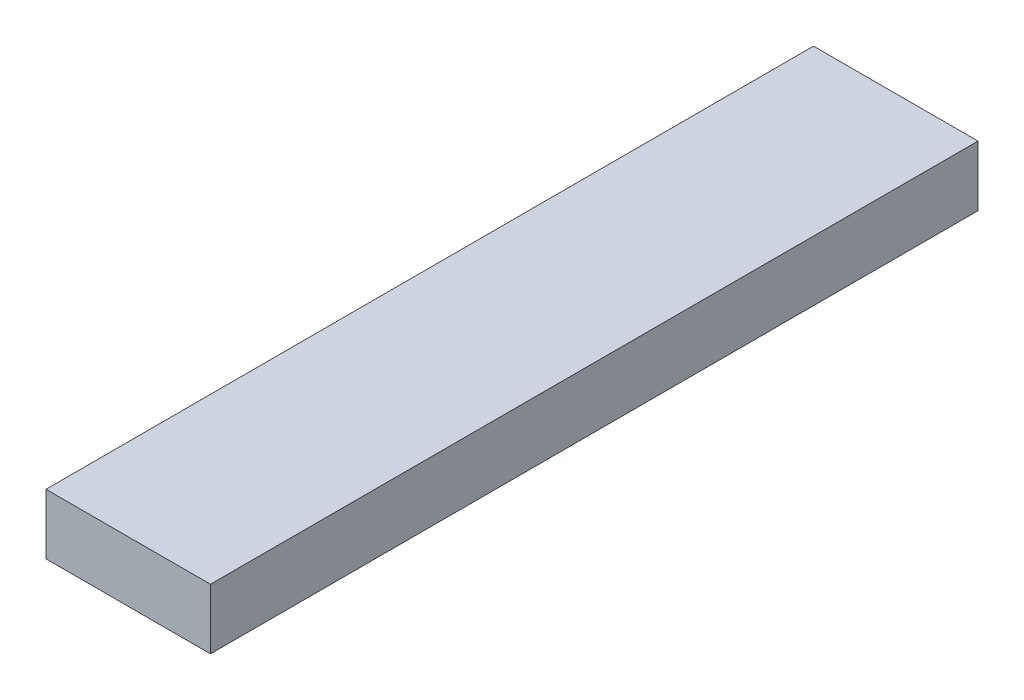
SolidWorks part; units mm, degrees
ref_plane "Plan1" through (0, 0, 0) normal (0, 0, 1) x (1, 0, 0)
ref_plane "Plan2" through (0, 0, 0) normal (0, 1, 0) x (1, 0, 0)
ref_plane "Plan3" through (0, 0, 0) normal (1, 0, 0) x (0, 0, -1)
sketch "Esquisse1" plane through (0, 0, 0) normal (0, 0, 1) x (1, 0, 0)
  line L0 (0, 8.5497) -> (0, -36.4816) construction
  line L1 (-15, -11) -> (15, -11)
  line L2 (-15, -11) -> (-15, 0)
  line L3 (-15, 0) -> (15, 0)
  line L4 (15, -11) -> (15, 0)
  dimension "D1" = 30
  dimension "D2" = 11
extrude "Base-Extrusion" add sketch "Esquisse1" along normal blind 140
